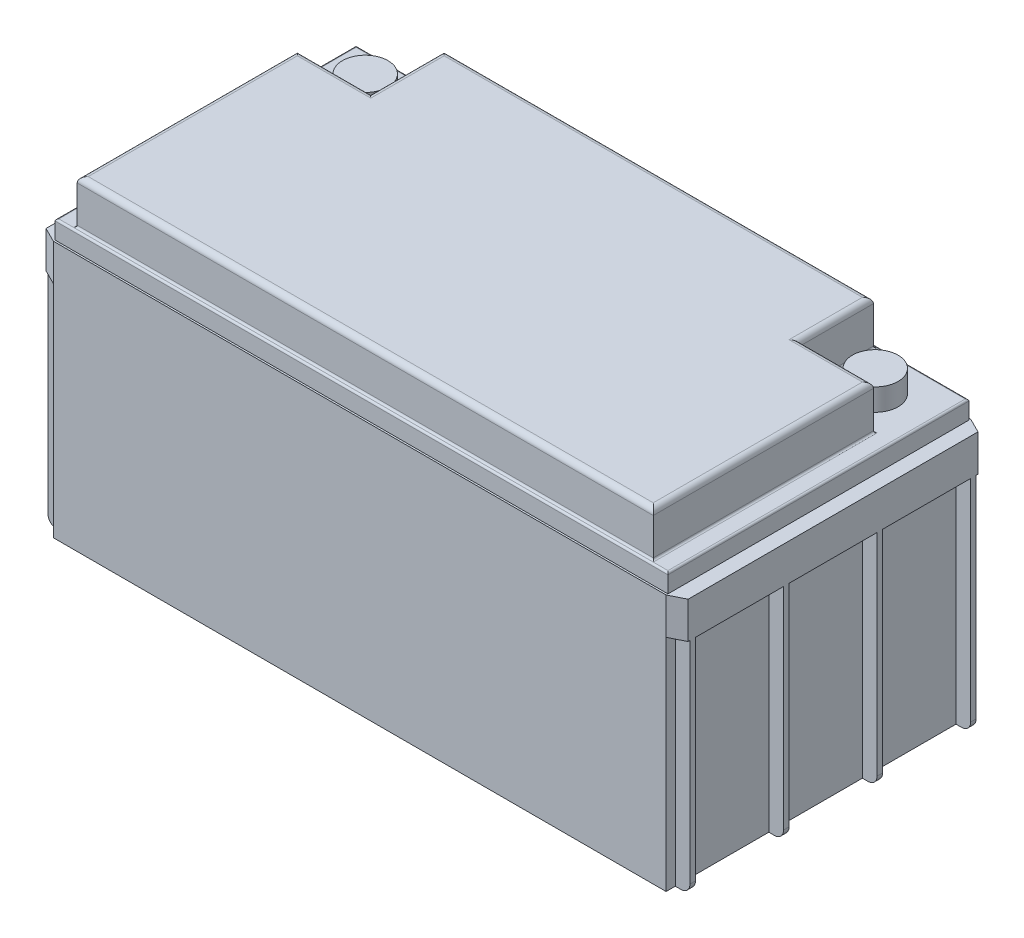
SolidWorks part; units mm, degrees
extrude "Base-Extrude" add sketch "Sketch2" along normal mid plane 166
sketch "Sketch2" plane through (0, 0, 0) normal (0, 0, 1) x (1, 0, 0)
  line L1 (0, 0) -> (350, 0)
  line L2 (0, 0) -> (0, 140)
  line L3 (0, 140) -> (350, 140)
  line L4 (350, 0) -> (350, 140)
  dimension "D1" = 350
  dimension "D2" = 140
extrude "Cut-Extrude1" cut sketch "Sketch3" against normal blind 120
sketch "Sketch3" plane through (0, 0, 0) normal (0, -1, 0) x (1, 0, 0)
  line L0 (175, 83) -> (175, -94.5773) construction
  line L1 (0, 83) -> (350, 83) construction
  line L2 (0, 83) -> (0, 78)
  line L3 (350, 83) -> (342, 83)
  line L4 (350, 83) -> (350, 78)
  line L5 (350, 78) -> (342, 78)
  line L6 (342, 83) -> (342, 78)
  line L7 (0, 83) -> (8, 83)
  line L8 (8, 83) -> (8, 78)
  line L9 (0, 78) -> (8, 78)
  line L10 (350, 83) -> (350, -83) construction
  line L11 (350, 75) -> (342, 75)
  line L12 (350, 75) -> (350, 27)
  line L13 (350, 27) -> (342, 27)
  line L14 (342, 75) -> (342, 27)
  line L15 (0, 75) -> (0, 27)
  line L16 (0, 75) -> (8, 75)
  line L17 (8, 75) -> (8, 27)
  line L18 (0, 27) -> (8, 27)
  line L19 (0, 24) -> (0, -24)
  line L20 (350, 24) -> (342, 24)
  line L21 (350, 24) -> (350, -24)
  line L22 (350, -24) -> (342, -24)
  line L23 (342, 24) -> (342, -24)
  line L24 (0, 24) -> (8, 24)
  line L25 (8, 24) -> (8, -24)
  line L26 (0, -24) -> (8, -24)
  line L27 (0, -27) -> (0, -75)
  line L28 (350, -27) -> (342, -27)
  line L29 (350, -27) -> (350, -75)
  line L30 (350, -75) -> (342, -75)
  line L31 (342, -27) -> (342, -75)
  line L32 (0, -27) -> (8, -27)
  line L33 (8, -27) -> (8, -75)
  line L34 (0, -75) -> (8, -75)
  line L35 (0, -83) -> (0, -78)
  line L36 (350, -83) -> (342, -83)
  line L37 (350, -83) -> (350, -78)
  line L38 (350, -78) -> (342, -78)
  line L39 (342, -83) -> (342, -78)
  line L40 (0, -83) -> (8, -83)
  line L41 (8, -83) -> (8, -78)
  line L42 (0, -78) -> (8, -78)
  dimension "D1" = 8
  dimension "D2" = 5
  dimension "D3" = 5
  dimension "D4" = 3
  dimension "D5" = 3
  dimension "D6" = 3
  dimension "D7" = 3
  dimension "D8" = 48
  dimension "D9" = 48
extrude "Cut-Extrude2" cut sketch "Sketch4" against normal through all
sketch "Sketch4" plane through (0, 140, 0) normal (0, 1, 0) x (-1, 0, 0)
  line L0 (0, -83) -> (-8, -83)
  line L1 (-350, 83) -> (-350, -83) construction
  line L2 (-350, 79) -> (-342, 83)
  line L3 (-350, -79) -> (-342, -83)
  line L4 (-350, 83) -> (0, 83) construction
  line L6 (0, -79) -> (0, -83)
  line L7 (-350, 79) -> (-350, 83)
  line L8 (-350, -79) -> (-350, -83)
  line L9 (-350, 83) -> (-342, 83)
  line L10 (-350, -83) -> (-342, -83)
  line L11 (-175, 83) -> (-175, -95.6932) construction
  line L12 (0, -79) -> (-8, -83)
  line L13 (0, 83) -> (-8, 83)
  line L14 (0, 79) -> (0, 83)
  line L15 (0, 79) -> (-8, 83)
  dimension "D1" = 4
fillet "Fillet1" radius 5 4 edges at (350, 0, 76.5) (350, 0, 25.5) (350, 0, -25.5) (350, 0, -76.5)
fillet "Fillet2" radius 5 4 edges at (0, 0, 76.5) (0, 0, 25.5) (0, 0, -25.5) (0, 0, -76.5)
ref_plane "Front" through (0, 0, 0) normal (0, 0, 1) x (1, 0, 0)
ref_plane "Top" through (0, 0, 0) normal (0, 1, 0) x (1, 0, 0)
ref_plane "Right" through (0, 0, 0) normal (1, 0, 0) x (0, 0, -1)
sketch "Sketch5" plane through (0, 140, 0) normal (0, 1, 0) x (-1, 0, 0)
  line L0 (-342, 83) -> (-8, 83) construction
  line L1 (-342, 82) -> (-8, 82)
  line L2 (-342, 82) -> (-342, -82)
  line L3 (-342, -82) -> (-8, -82)
  line L4 (-8, 82) -> (-8, -82)
  line L5 (-342, -83) -> (-8, -83) construction
  line L6 (0, 79) -> (0, -79) construction
  line L7 (-350, 79) -> (-350, -79) construction
  dimension "D1" = 1
  dimension "D2" = 1
  dimension "D3" = 8
  dimension "D4" = 8
extrude "Boss-Extrude1" add sketch "Sketch5" along normal blind 10
sketch "Sketch6" plane through (0, 150, 0) normal (0, 1, 0) x (-1, 0, 0)
  line L0 (-8, 82) -> (-342, 82) construction
  line L1 (-332, 80) -> (-18, 80)
  line L2 (-332, 80) -> (-332, -40)
  line L3 (-292, -80) -> (-58, -80)
  line L4 (-18, 80) -> (-18, -40)
  line L5 (-342, -82) -> (-8, -82) construction
  line L6 (-342, 82) -> (-342, -82) construction
  line L7 (-8, -82) -> (-8, 82) construction
  line L8 (-292, -80) -> (-292, -40)
  line L9 (-292, -40) -> (-332, -40)
  line L10 (-175, -80) -> (-175, 25.3953) construction
  line L11 (-58, -80) -> (-58, -40)
  line L12 (-58, -40) -> (-18, -40)
  dimension "D1" = 2
  dimension "D2" = 2
  dimension "D3" = 10
  dimension "D4" = 10
  dimension "D5" = 40
  dimension "D6" = 40
extrude "Boss-Extrude2" add sketch "Sketch6" along normal blind 24
fillet "Fillet3" radius 3 8 edges at (332, 174, 20) (312, 174, -40) (292, 174, -60) (175, 174, -80) (58, 174, -60) (38, 174, -40) (18, 174, 20) (175, 174, 80)
fillet "Fillet4" radius 1 12 edges at (342, 150, 0) (175, 150, -82) (8, 150, 0) (175, 150, 82) (332, 150, 20) (312, 150, -40) (292, 150, -60) (175, 150, -80) (58, 150, -60) (38, 150, -40) (18, 150, 20) (175, 150, 80)
sketch "Sketch7" plane through (0, 150, 0) normal (0, 1, 0) x (-1, 0, 0)
  line L0 (-175, -77) -> (-175, 54.9599) construction
  line L1 (-289, -77) -> (-61, -77) construction
  line L2 (-341, -81) -> (-293, -81) construction
  line L3 (-341, 81) -> (-341, -81) construction
  circle A0 centre (-314, -59) radius 12.4332
  circle A1 centre (-36, -59) radius 12.4332
  dimension "D1" = 22
  dimension "D2" = 27
extrude "Boss-Extrude3" add sketch "Sketch7" along normal blind 12
sketch "Sketch8"
extrude "Cut-Extrude3" cut sketch "Sketch8" against normal blind 0.1
